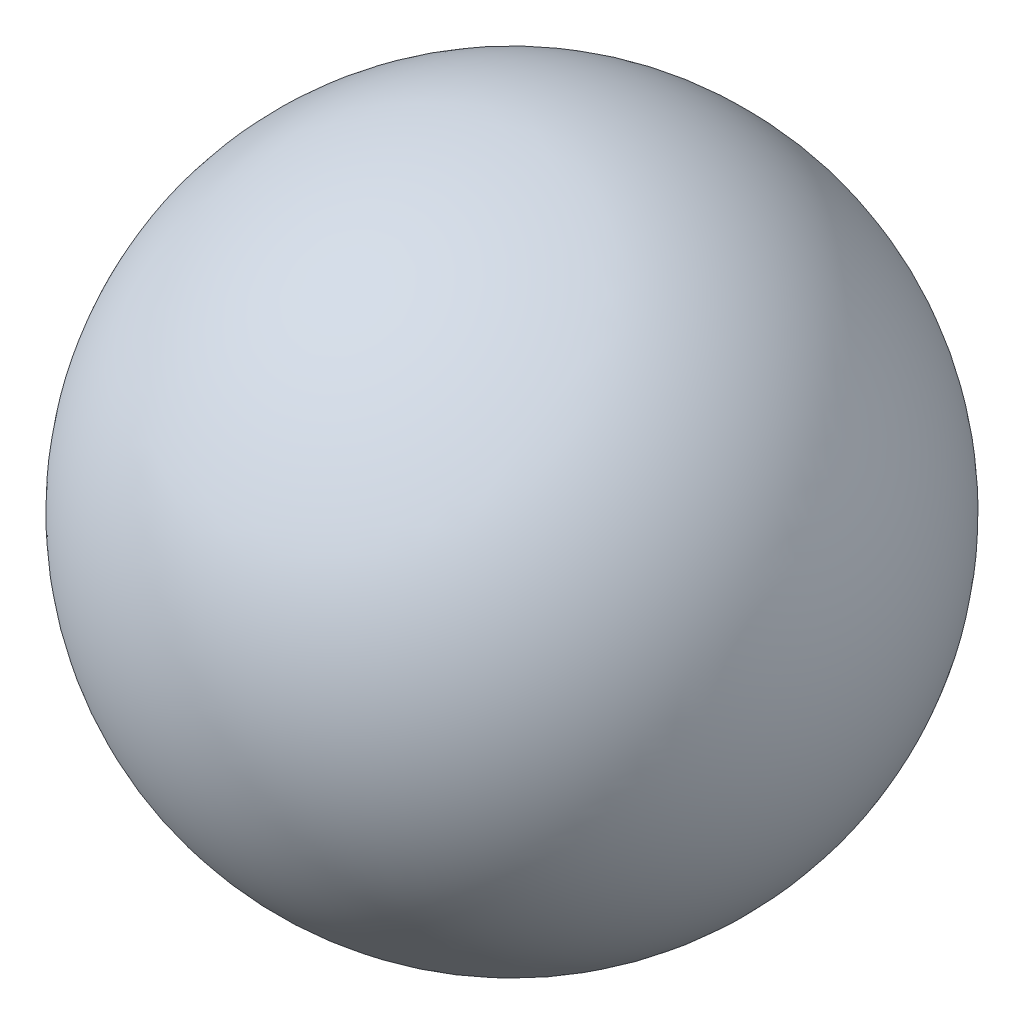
SolidWorks part; units mm, degrees
ref_plane "Plan1" through (0, 0, 0) normal (0, 0, 1) x (1, 0, 0)
ref_plane "Plan2" through (0, 0, 0) normal (0, 1, 0) x (1, 0, 0)
ref_plane "Plan3" through (0, 0, 0) normal (1, 0, 0) x (0, 0, -1)
sketch "Esquisse1" plane through (0, 0, 0) normal (0, 0, 1) x (1, 0, 0)
  line L0 (0, 0) -> (10, 0) construction
  line L1 (3.95, 0) -> (-3.95, 0)
  arc A0 (3.95, 0) -> (-3.95, 0) centre (0, 0) ccw
  dimension "D1" = 7.9
revolve "Base-Révolution" add sketch "Esquisse1" angle 360 about L0
